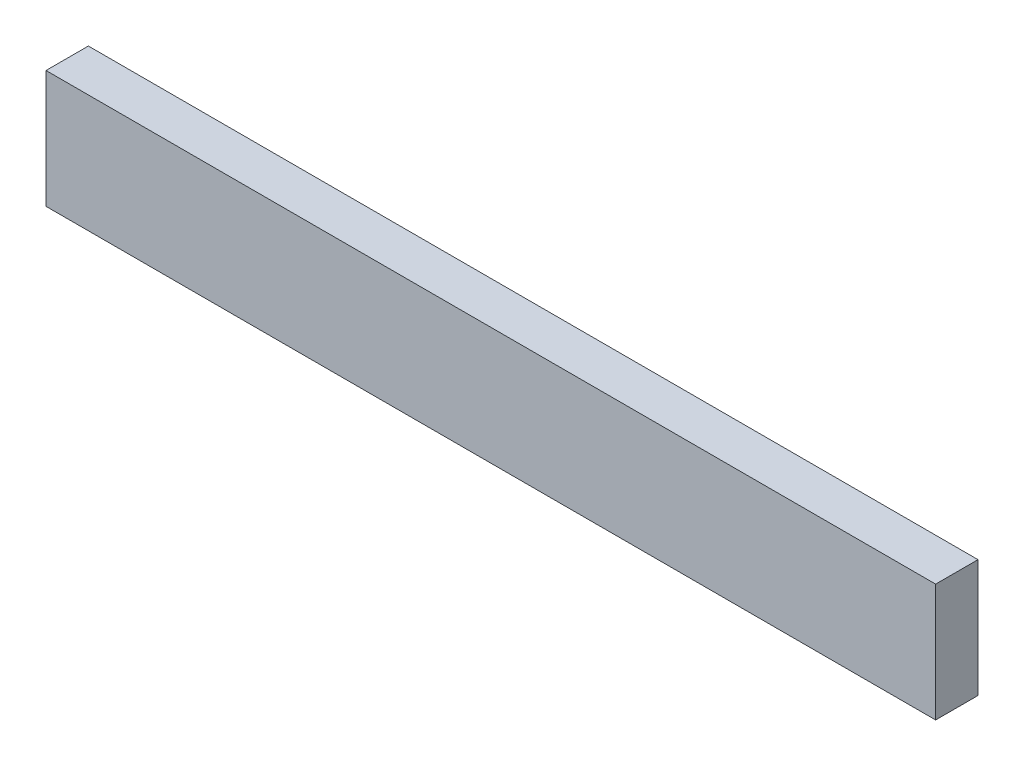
SolidWorks part; units mm, degrees
ref_plane "Plan de face" through (0, 0, 0) normal (0, 0, 1) x (1, 0, 0)
ref_plane "Plan de dessus" through (0, 0, 0) normal (0, 1, 0) x (1, 0, 0)
ref_plane "Plan de droite" through (0, 0, 0) normal (1, 0, 0) x (0, 0, -1)
sketch "Esquisse1" plane through (0, 0, 0) normal (0, 0, 1) x (1, 0, 0)
  line L1 (-189, -25) -> (189, -25)
  line L2 (-189, -25) -> (-189, 25)
  line L3 (-189, 25) -> (189, 25)
  line L4 (189, -25) -> (189, 25)
  line L5 (-189, -25) -> (189, 25) construction
  line L6 (-189, 25) -> (189, -25) construction
  point P0 (0, 0)
  dimension "D1" = 378
  dimension "D2" = 50
extrude "Boss.-Extru.1" add sketch "Esquisse1" along normal blind 18
